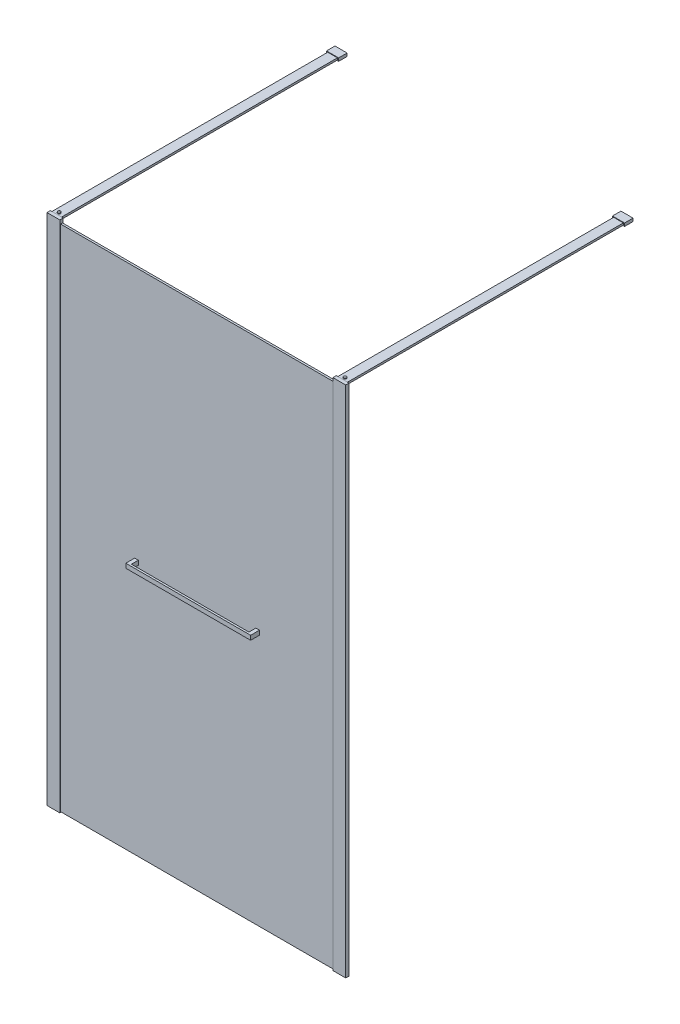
SolidWorks part; units mm, degrees
ref_plane "Płaszczyzna przednia" through (0, 0, 0) normal (0, 0, 1) x (1, 0, 0)
ref_plane "Płaszczyzna górna" through (0, 0, 0) normal (0, 1, 0) x (1, 0, 0)
ref_plane "Płaszczyzna prawa" through (0, 0, 0) normal (1, 0, 0) x (0, 0, -1)
sketch "Szkic1" plane through (0, 0, 0) normal (0, 1, 0) x (1, 0, 0)
  line L0 (0, 0) -> (0, 14)
  line L1 (0, 14) -> (53, 14)
  line L2 (53, 14) -> (53, 11)
  line L3 (53, 11) -> (42.9, 11)
  line L4 (42.9, 11) -> (42.9, 3)
  line L5 (42.9, 3) -> (53, 3)
  line L6 (53, 3) -> (53, 0)
  line L7 (53, 0) -> (0, 0)
  dimension "D1" = 53
  dimension "D2" = 14
  dimension "D3" = 10.1
  dimension "D5" = 8
extrude "Dodanie-wyciągnięcie1" add sketch "Szkic1" along normal blind 2100 from offset 3
sketch "Szkic2" plane through (0, 3, 0) normal (0, -1, 0) x (1, 0, 0)
  line L0 (42.9, -11) -> (53, -11) construction
  line L1 (42.9, -3) -> (1189.9, -3)
  line L2 (42.9, -3) -> (42.9, -11)
  line L3 (42.9, -11) -> (1189.9, -11)
  line L4 (1189.9, -3) -> (1189.9, -11)
  dimension "D1" = 1147
extrude "Dodanie-wyciągnięcie2" add sketch "Szkic2" against normal blind 2100 separate body
sketch "Szkic3" plane through (0, 3, 0) normal (0, -1, 0) x (1, 0, 0)
  line L0 (1179.8, -3) -> (1179.8, 0)
  line L1 (1189.9, -3) -> (42.9, -3) construction
  line L2 (1179.8, 0) -> (1232.8, 0)
  line L3 (1232.8, 0) -> (1232.8, -14)
  line L4 (1232.8, -14) -> (1179.8, -14)
  line L5 (1179.8, -14) -> (1179.8, -11)
  line L6 (1179.8, -11) -> (1189.9, -11)
  line L7 (1189.9, -11) -> (1189.9, -3)
  line L8 (1189.9, -3) -> (1179.8, -3)
  line L9 (42.9, -11) -> (1189.9, -11) construction
  line L10 (1189.9, -11) -> (1189.9, -3) construction
  dimension "D1" = 10.1
  dimension "D2" = 14
  dimension "D4" = 53
extrude "Dodanie-wyciągnięcie3" add sketch "Szkic3" against normal blind 2100 separate body
sketch "Szkic4" plane through (0, 2103, 0) normal (0, 1, 0) x (1, 0, 0)
  line L1 (0, 14) -> (53, 14)
  line L2 (0, 14) -> (0, 0)
  line L3 (0, 0) -> (53, 0)
  line L4 (53, 14) -> (53, 0)
extrude "Dodanie-wyciągnięcie4" add sketch "Szkic4" along normal blind 16
sketch "Szkic5" plane through (0, 2103, 0) normal (0, 1, 0) x (1, 0, 0)
  line L1 (1232.8, 14) -> (1179.8, 14)
  line L2 (1232.8, 14) -> (1232.8, 0)
  line L3 (1232.8, 0) -> (1179.8, 0)
  line L4 (1179.8, 14) -> (1179.8, 0)
extrude "Dodanie-wyciągnięcie5" add sketch "Szkic5" along normal blind 16
sketch "Szkic7" plane through (0, 3, 0) normal (0, -1, 0) x (1, 0, 0)
  line L1 (1179.8, 0) -> (1232.8, 0)
  line L2 (1179.8, 0) -> (1179.8, -14)
  line L3 (1179.8, -14) -> (1232.8, -14)
  line L4 (1232.8, 0) -> (1232.8, -14)
extrude "Dodanie-wyciągnięcie7" add sketch "Szkic7" along normal blind 3
sketch "Szkic8" plane through (0, 3, 0) normal (0, -1, 0) x (1, 0, 0)
  line L1 (0, 0) -> (53, 0)
  line L2 (0, 0) -> (0, -14)
  line L3 (0, -14) -> (53, -14)
  line L4 (53, 0) -> (53, -14)
extrude "Dodanie-wyciągnięcie8" add sketch "Szkic8" along normal blind 3
sketch "Szkic9" plane through (0, 0, -14) normal (0, 0, -1) x (-1, 0, 0)
  line L0 (-1232.8, 2119) -> (-1179.8, 2119) construction
  line L1 (-1226.3, 2119) -> (-1186.3, 2119)
  line L2 (-1226.3, 2119) -> (-1226.3, 2111)
  line L3 (-1226.3, 2111) -> (-1186.3, 2111)
  line L4 (-1186.3, 2119) -> (-1186.3, 2111)
  line L5 (-1232.8, 2119) -> (-1232.8, 0) construction
  line L6 (-1179.8, 2119) -> (-1179.8, 0) construction
  line L7 (-53, 2119) -> (-53, 0) construction
  line L8 (-46.5, 2119) -> (-6.5, 2119)
  line L9 (-46.5, 2119) -> (-46.5, 2111)
  line L10 (-46.5, 2111) -> (-6.5, 2111)
  line L11 (-6.5, 2119) -> (-6.5, 2111)
  line L12 (0, 2119) -> (0, 0) construction
  line L13 (-53, 2119) -> (0, 2119) construction
  dimension "D1" = 6.5
  dimension "D2" = 6.5
  dimension "D3" = 8
  dimension "D4" = 6.5
  dimension "D5" = 6.5
  dimension "D6" = 8
extrude "Dodanie-wyciągnięcie9" add sketch "Szkic9" along normal blind 1170 separate body
sketch "Szkic10" plane through (0, 0, -1184) normal (0, 0, -1) x (-1, 0, 0)
  line L0 (-1206.3, 2119) -> (-1206.3, 2115) construction
  line L1 (-1231.3, 2121.25) -> (-1181.3, 2121.25)
  line L2 (-1231.3, 2121.25) -> (-1231.3, 2108.75)
  line L3 (-1231.3, 2108.75) -> (-1181.3, 2108.75)
  line L4 (-1181.3, 2121.25) -> (-1181.3, 2108.75)
  line L5 (-1231.3, 2121.25) -> (-1181.3, 2108.75) construction
  line L6 (-1231.3, 2108.75) -> (-1181.3, 2121.25) construction
  line L7 (-1186.3, 2119) -> (-1226.3, 2119) construction
  line L8 (-1206.3, 2115) -> (-1226.3, 2115) construction
  line L9 (-1226.3, 2119) -> (-1226.3, 2111) construction
  line L10 (-26.5, 2119) -> (-26.5, 2115) construction
  line L11 (-51.5, 2121.25) -> (-1.5, 2121.25)
  line L12 (-51.5, 2121.25) -> (-51.5, 2108.75)
  line L13 (-51.5, 2108.75) -> (-1.5, 2108.75)
  line L14 (-1.5, 2121.25) -> (-1.5, 2108.75)
  line L15 (-51.5, 2121.25) -> (-1.5, 2108.75) construction
  line L16 (-51.5, 2108.75) -> (-1.5, 2121.25) construction
  line L17 (-6.5, 2119) -> (-46.5, 2119) construction
  line L18 (-26.5, 2115) -> (-46.5, 2115) construction
  line L19 (-46.5, 2119) -> (-46.5, 2111) construction
  point P0 (-1206.3, 2115)
  point P9 (-26.5, 2115)
  dimension "D1" = 12.5
  dimension "D2" = 50
  dimension "D3" = 12.5
  dimension "D4" = 50
extrude "Dodanie-wyciągnięcie10" add sketch "Szkic10" along normal blind 35 from offset 32
ref_plane "Płaszczyzna1" through (1206.3, 0, 0) normal (1, 0, 0) x (0, 0, -1)
sketch "Szkic11" plane through (1206.3, 0, 0) normal (1, 0, 0) x (0, 0, -1)
  line L0 (24, 2119) -> (24, 2127.4416) construction
  line L1 (24, 2119) -> (34.6926, 2119) construction
  line L2 (29.9, 2119) -> (29.65, 2122.8)
  line L3 (24, 2124.7) -> (30.2413, 2124.7) construction
  line L4 (24, 2124.7) -> (24, 2124.2)
  line L5 (1152, 2119) -> (14, 2119) construction
  line L6 (14, 2119) -> (14, 2111) construction
  line L7 (29.3989, 2119) -> (29.9, 2119)
  line L9 (29.1663, 2122.5357) -> (29.3989, 2119)
  arc A0 (24, 2124.7) -> (29.65, 2122.8) centre (24, 2115.3493) cw
  arc A1 (29.1663, 2122.5357) -> (24, 2124.2) centre (24, 2115.3493) ccw
  dimension "D1" = 0.5
  dimension "D2" = 11.3
  dimension "D3" = 5.7
  dimension "D4" = 3.8
  dimension "D5" = 11.8
  dimension "D6" = 0.5
  dimension "D7" = 10
revolve "Obrót1" add sketch "Szkic11" angle 360 about L0
ref_plane "Płaszczyzna2" through (26.5, 0, 0) normal (1, 0, 0) x (0, 0, -1)
sketch "Szkic14" plane through (26.5, 0, 0) normal (1, 0, 0) x (0, 0, -1)
  line L0 (24, 2119) -> (24, 2141.8878) construction
  line L1 (24, 2119) -> (23.0807, 2119) construction
  line L2 (29.9, 2119) -> (29.65, 2122.8)
  line L3 (24, 2124.7) -> (18.6294, 2124.7) construction
  line L4 (24, 2124.7) -> (24, 2124.2)
  line L5 (29.3989, 2119) -> (29.9, 2119)
  line L6 (29.1663, 2122.5357) -> (29.3989, 2119)
  line L7 (1152, 2119) -> (14, 2119) construction
  line L8 (14, 2119) -> (14, 2111) construction
  arc A0 (24, 2124.7) -> (29.65, 2122.8) centre (24, 2115.3493) cw
  arc A1 (29.1663, 2122.5357) -> (24, 2124.2) centre (24, 2115.3493) ccw
  dimension "D1" = 5.7
  dimension "D2" = 3.8
  dimension "D3" = 0.5
  dimension "D4" = 0.5
  dimension "D5" = 11.3
  dimension "D6" = 11.8
  dimension "D7" = 10
revolve "Obrót2" add sketch "Szkic14" angle 360 about L0
sketch "Szkic12" plane through (0, 0, -3) normal (0, 0, 1) x (1, 0, 0)
  line L0 (616.4, 1409.7928) -> (616.4, 762.3594) construction
  line L1 (366.4, 1053) -> (866.4, 1053) construction
  line L2 (42.9, 2103) -> (42.9, 3) construction
  line L3 (1189.9, 2103) -> (1189.9, 3) construction
  line L5 (358.9, 1062) -> (373.9, 1062)
  line L6 (358.9, 1062) -> (358.9, 1044)
  line L7 (358.9, 1044) -> (373.9, 1044)
  line L8 (373.9, 1062) -> (373.9, 1044)
  line L9 (358.9, 1062) -> (373.9, 1044) construction
  line L10 (358.9, 1044) -> (373.9, 1062) construction
  line L11 (858.9, 1062) -> (873.9, 1062)
  line L12 (858.9, 1062) -> (858.9, 1044)
  line L13 (858.9, 1044) -> (873.9, 1044)
  line L14 (873.9, 1062) -> (873.9, 1044)
  line L15 (858.9, 1062) -> (873.9, 1044) construction
  line L16 (858.9, 1044) -> (873.9, 1062) construction
  dimension "D1" = 1053
  dimension "D2" = 500
  dimension "D3" = 15
  dimension "D4" = 18
extrude "Dodanie-wyciągnięcie11" add sketch "Szkic12" along normal blind 36.5 and the other way blind 18 separate body
sketch "Szkic13" plane through (373.9, 0, 0) normal (1, 0, 0) x (0, 0, -1)
  line L0 (21, 1044) -> (-33.5, 1044) construction
  line L1 (-33.5, 1062) -> (-25.5, 1062)
  line L2 (-33.5, 1062) -> (-33.5, 1044)
  line L3 (-33.5, 1044) -> (-25.5, 1044)
  line L4 (-25.5, 1062) -> (-25.5, 1044)
  dimension "D1" = 8
extrude "Dodanie-wyciągnięcie12" add sketch "Szkic13" along normal up to surface (485 mm away)
